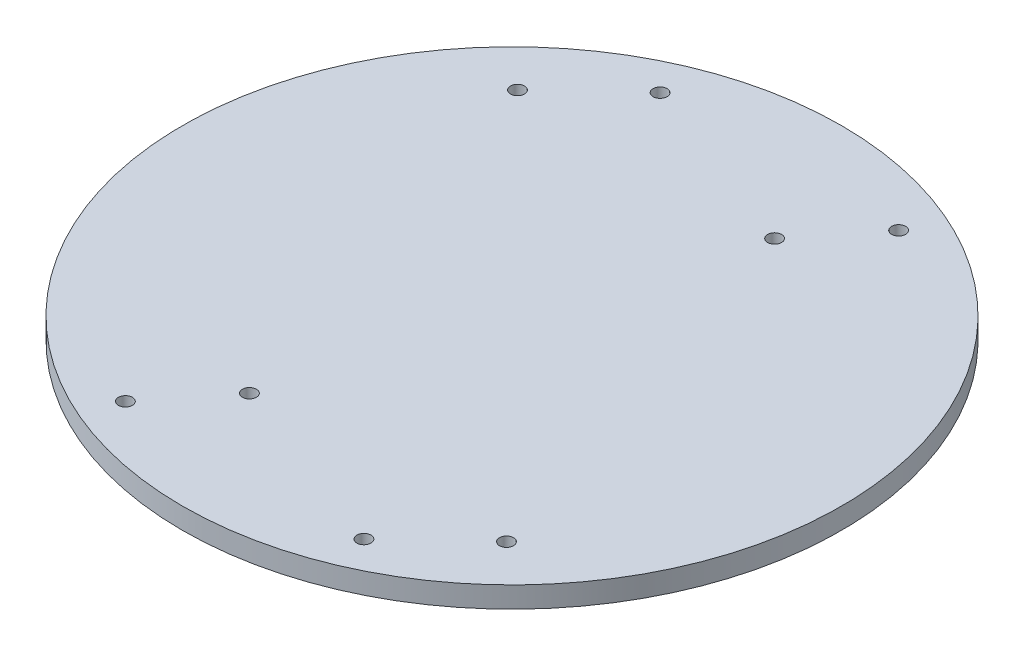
SolidWorks part; units mm, degrees
ref_plane "Front Plane" through (0, 0, 0) normal (0, 0, 1) x (1, 0, 0)
ref_plane "Top Plane" through (0, 0, 0) normal (0, 1, 0) x (1, 0, 0)
ref_plane "Right Plane" through (0, 0, 0) normal (1, 0, 0) x (0, 0, -1)
sketch "Sketch1" plane through (0, 0, 0) normal (0, 1, 0) x (1, 0, 0)
  circle A0 centre (0, 0) radius 47
  dimension "D1" = 94
extrude "Base" add sketch "Sketch1" along normal mid plane 3
sketch "Sketch6" plane through (0, 1.5, 0) normal (0, 1, 0) x (1, 0, 0)
  line L0 (35, 28.2843) -> (-35, 28.2843) construction
  line L1 (-35, 28.2843) -> (-35, -28.2843) construction
  line L2 (-35, -28.2843) -> (35, -28.2843) construction
  line L3 (35, -28.2843) -> (35, 28.2843) construction
  line L4 (27.5, 28.2843) -> (27.5, -28.2843) construction
  line L5 (-27.5, 28.2843) -> (-27.5, -28.2843) construction
  line L6 (0, 28.2843) -> (0, -28.2843) construction
  line L7 (9.1667, 28.2843) -> (9.1667, -28.2843) construction
  line L8 (-9.1667, 28.2843) -> (-9.1667, -28.2843) construction
  line L9 (-5.8578, 18.0745) -> (-44.6629, 5.4981) construction
  line L10 (-44.6629, 5.4981) -> (-32.9473, -30.6508) construction
  line L11 (-9.1667, -28.2843) -> (9.1667, 28.2843) construction
  line L12 (-32.9473, -30.6508) -> (5.8578, -18.0745) construction
  line L13 (27.5, -28.2843) -> (18.3333, -41.0961) construction
  line L14 (-9.1667, 28.2843) -> (9.1667, -28.2843) construction
  line L15 (18.3333, -41.0961) -> (9.1667, -28.2843) construction
  line L16 (0, 0) -> (45, 0) construction
  circle A0 centre (0, 0) radius 45 construction
  circle A1 centre (27.5, -28.2843) radius 1
  circle A2 centre (9.1667, 28.2843) radius 1
  circle A3 centre (-9.1667, -28.2843) radius 1
  circle A4 centre (-27.5, 28.2843) radius 1
  circle A5 centre (17.0093, -38.128) radius 1
  circle A6 centre (17.0093, -38.128) radius 3.25 construction
  circle A7 centre (17.0093, 38.128) radius 1
  circle A8 centre (-17.0093, 38.128) radius 1
  circle A9 centre (-17.0093, -38.128) radius 1
  dimension "D1" = 90
  dimension "D4" = 2
  dimension "D7" = 2
  dimension "D9" = 6.5
  dimension "D2" = 70
  dimension "D3" = 7.5
  dimension "D5" = 18.3333
  dimension "D6" = 38
extrude "Holes Pattern" cut sketch "Sketch6" against normal through all
equation "\"D1@Sketch1\"=\"base diameter@values@params.sldprt\"-2*\"width keep@values@params.sldprt\""
equation "\"D1@Base\"=\"width keep@values@params.sldprt\""
